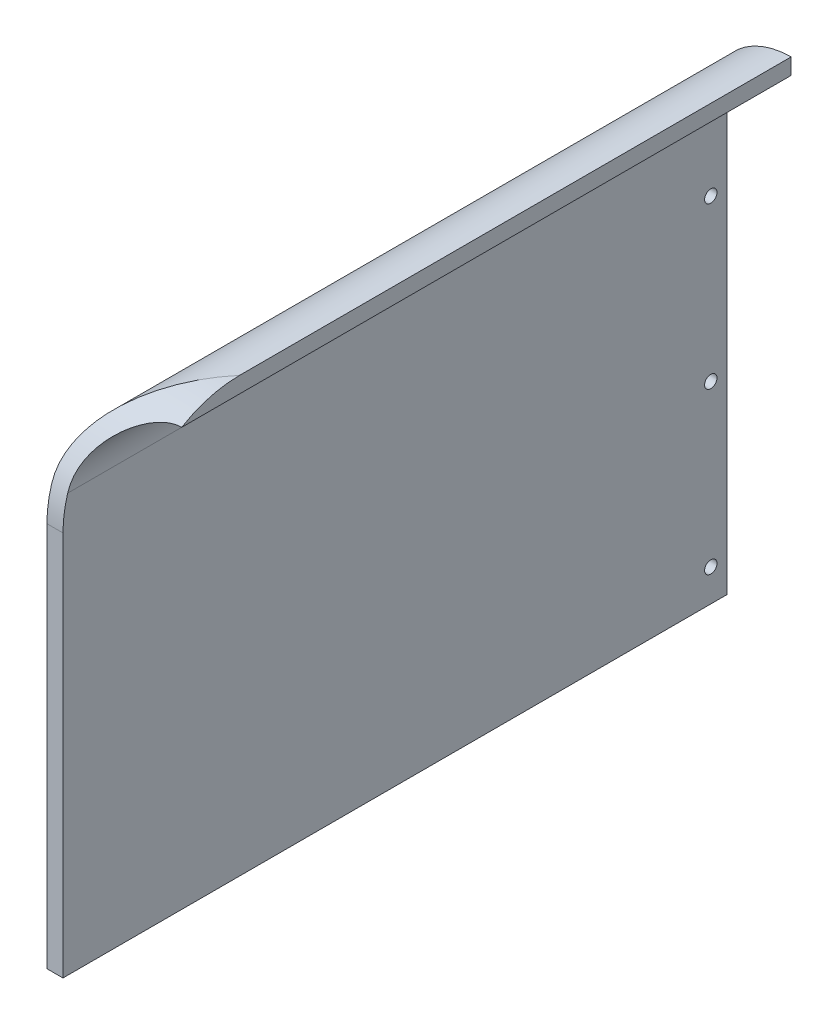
SolidWorks part; units mm, degrees
ref_plane "Front" through (0, 0, 0) normal (0, 0, 1) x (1, 0, 0)
ref_plane "Top" through (0, 0, 0) normal (0, 1, 0) x (1, 0, 0)
ref_plane "Right" through (0, 0, 0) normal (1, 0, 0) x (0, 0, -1)
sketch "Sketch1" plane through (0, 0, 0) normal (1, 0, 0) x (0, 0, -1)
  line L1 (0, 0) -> (525.018, 0)
  line L2 (0, 0) -> (0, 304.8)
  line L3 (0, 304.8) -> (525.018, 304.8)
  line L4 (525.018, 0) -> (525.018, 304.8)
  dimension "D1" = 525.018
  dimension "D2" = 304.8
extrude "Extrude1" add sketch "Sketch1" along normal blind 12.7
sketch "Sketch2" plane through (0, 0, 0) normal (-1, 0, 0) x (0, 0, 1)
  line L0 (-512.318, 304.8) -> (-512.318, 0) construction
  line L1 (-525.018, 304.8) -> (0, 304.8) construction
  line L2 (0, 0) -> (-525.018, 0) construction
  line L3 (-525.018, 0) -> (-525.018, 304.8) construction
  circle A0 centre (-512.318, 25.4) radius 4.9022
  circle A1 centre (-512.318, 279.4) radius 4.9022
  circle A2 centre (-512.318, 152.4) radius 4.9022
  dimension "D1" = 9.8044
  dimension "D4" = 25.4
  dimension "D5" = 152.4
  dimension "D2" = 12.7
  dimension "D3" = 25.4
extrude "Extrude2" cut sketch "Sketch2" against normal through all
fillet "Fillet1" [suppressed] radius 88.9
sketch "Sketch3" plane through (0, 0, -525.018) normal (0, 0, -1) x (-1, 0, 0)
  line L0 (-12.7, 0) -> (-12.7, 304.8) construction
  line L1 (0, 304.8) -> (-12.7, 304.8)
  line L3 (-6.35, 304.8) -> (-6.35, 291.7831) construction
  line L4 (-12.7, 304.8) -> (-12.7, 330.2)
  line L6 (0, 304.8) -> (0, 330.2)
  line L7 (-63.5, 381) -> (-63.5, 393.7)
  arc A2 (-63.5, 393.7) -> (0, 330.2) centre (-63.5, 330.2) cw
  arc A3 (-63.5, 381) -> (-12.7, 330.2) centre (-63.5, 330.2) cw
  dimension "D1" = 25.4
extrude "Extrude3" add sketch "Sketch3" against normal up to surface (525.018 mm away)
sketch "Sketch4" plane through (0, 0, 0) normal (-1, 0, 0) x (0, 0, 1)
  line L2 (0, 330.2) -> (0, 0) construction
  line L5 (0, 304.8) -> (0, 435.3272)
  line L6 (0, 435.3272) -> (-88.9, 435.3272)
  line L7 (-88.9, 393.7) -> (-88.9, 435.3272)
  arc A0 (0, 304.8) -> (-88.9, 393.7) centre (-88.9, 304.8) ccw
  dimension "D1" = 177.8
  dimension "D2" = 88.9
extrude "Extrude4" cut sketch "Sketch4" against normal through all
